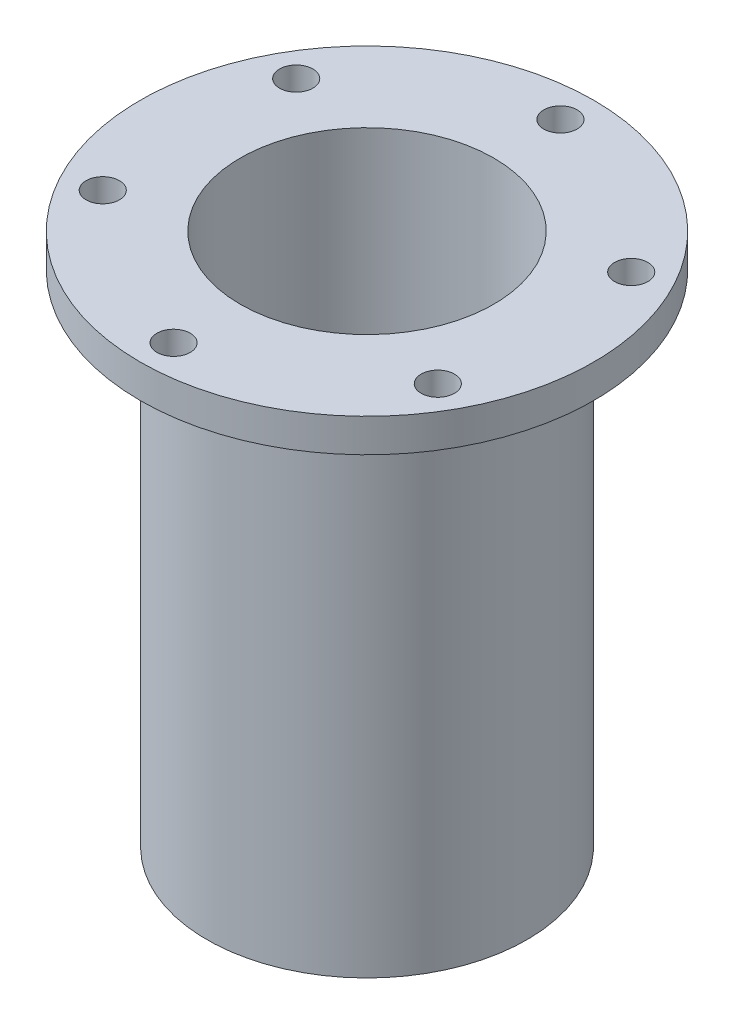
SolidWorks part; units mm, degrees
ref_plane "Front Plane" through (0, 0, 0) normal (0, 0, 1) x (1, 0, 0)
ref_plane "Top Plane" through (0, 0, 0) normal (0, 1, 0) x (1, 0, 0)
ref_plane "Right Plane" through (0, 0, 0) normal (1, 0, 0) x (0, 0, -1)
sketch "Sketch1" plane through (0, 0, 0) normal (0, 0, 1) x (1, 0, 0)
  line L0 (19, 0) -> (19, 80)
  line L1 (19, 80) -> (34, 80)
  line L2 (34, 80) -> (34, 75)
  line L3 (34, 75) -> (24, 75)
  line L4 (24, 75) -> (24, 0)
  line L5 (24, 0) -> (19, 0)
  line L6 (0, 0) -> (0, 26.1317) construction
  dimension "D1" = 19
  dimension "D2" = 24
  dimension "D3" = 10
  dimension "D4" = 5
  dimension "D5" = 80
revolve "Revolve1" add sketch "Sketch1" angle 360 about L6
sketch "Sketch2" plane through (0, 80, 0) normal (0, 1, 0) x (1, 0, 0)
  line L0 (0, 0) -> (0, 34) construction
  circle A0 centre (0, 0) radius 29 construction
  circle A1 centre (0, 0) radius 34 construction
  circle A2 centre (0, 29) radius 2.5
  circle A3 centre (25.1147, 14.5) radius 2.5
  circle A4 centre (25.1147, -14.5) radius 2.5
  circle A5 centre (0, -29) radius 2.5
  circle A6 centre (-25.1147, -14.5) radius 2.5
  circle A7 centre (-25.1147, 14.5) radius 2.5
  point P20 (0, 0)
  dimension "D1" = 5
  dimension "D2" = 5
  dimension "D3" = 6
extrude "Cut-Extrude1" cut sketch "Sketch2" against normal blind 10
